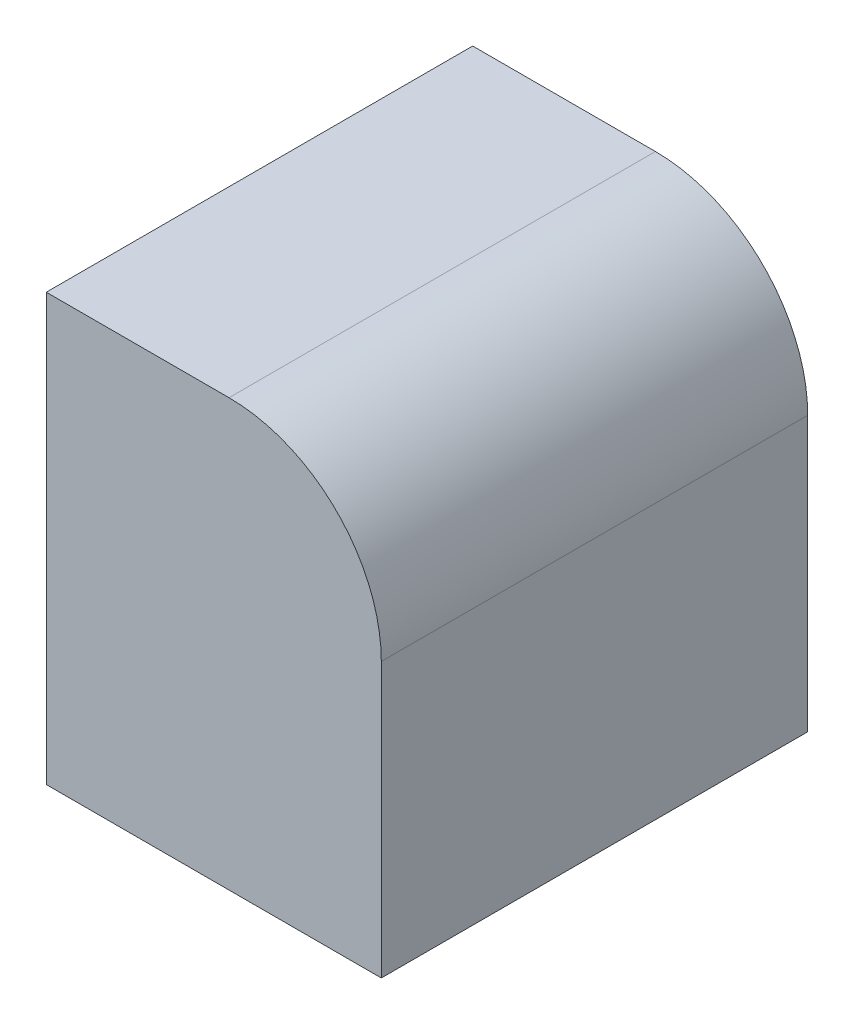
SolidWorks part; units mm, degrees
ref_plane "Front Plane" through (0, 0, 0) normal (0, 0, 1) x (1, 0, 0)
ref_plane "Top Plane" through (0, 0, 0) normal (0, 1, 0) x (1, 0, 0)
ref_plane "Right Plane" through (0, 0, 0) normal (1, 0, 0) x (0, 0, -1)
sketch "Sketch1" plane through (0, 0, 0) normal (1, 0, 0) x (0, 0, -1)
  line L1 (0, 0) -> (70, 0)
  line L2 (0, 0) -> (0, 70)
  line L3 (0, 70) -> (70, 70)
  line L4 (70, 0) -> (70, 70)
  dimension "D1" = 70
  dimension "D2" = 70
extrude "Boss-Extrude1" add sketch "Sketch1" along normal blind 55
fillet "Circular" radius 25 1 edges at (55, 70, -35)
sketch "Circular Profile"
fillet "Conic Rho" [suppressed] radius 25
sketch "Conic Profile 1" [suppressed] plane through (0, 0, 0) normal (0, 0, 1) x (1, 0, 0)
  spline S0 degree 2 poles (-494.058, -2903.9282) (72.149, -81.5934) (54.4644, 55.7847) (54.0651, 58.8862) (53.3213, 61.0643) (52.3438, 63.9266) (50.5847, 65.6651) (48.839, 67.3903) (45.9755, 68.3513) (43.8021, 69.0808) (40.7146, 69.4733) (-97.0074, 86.9815) (-2919.2807, -477.5552) knots -8.004243 -8.004243 -8.004243 0.25 0.25 0.375 0.375 0.5 0.5 0.625 0.625 0.75 0.75 9.061034 9.061034 9.061034 only from (55, 45) to (30, 70) construction
  spline S1 degree 2 poles (55, 45) (55, 51.6238) (54.4644, 55.7847) (54.0651, 58.8862) (53.3213, 61.0643) (52.3438, 63.9266) (50.5847, 65.6651) (48.839, 67.3903) (45.9755, 68.3513) (43.8021, 69.0808) (40.7146, 69.4733) (36.5718, 70) (30, 70) knots 0 0 0 0.25 0.25 0.375 0.375 0.5 0.5 0.625 0.625 0.75 0.75 1 1 1
fillet "Conic Radius" [suppressed] radius 25
sketch "Conic Profile 2" [suppressed] plane through (0, 0, 0) normal (0, 0, 1) x (1, 0, 0)
  spline S0 degree 2 poles (-552.787, -2892.3055) (73.7483, -83.6807) (54.4217, 55.7337) (53.9983, 58.7876) (53.2199, 60.9617) (52.2136, 63.772) (50.4463, 65.521) (48.6912, 67.2578) (45.88, 68.2489) (43.7064, 69.0152) (40.6572, 69.4322) (-99.1345, 88.5505) (-2907.7128, -536.071) knots -8.104548 -8.104548 -8.104548 0.25 0.25 0.375 0.375 0.5 0.5 0.625 0.625 0.75 0.75 9.167861 9.167861 9.167861 only from (55, 45) to (30, 70) construction
  spline S1 degree 2 poles (55, 45) (55, 51.5619) (54.4217, 55.7337) (53.9983, 58.7876) (53.2199, 60.9617) (52.2136, 63.772) (50.4463, 65.521) (48.6912, 67.2578) (45.88, 68.2489) (43.7064, 69.0152) (40.6572, 69.4322) (36.5056, 70) (30, 70) knots 0 0 0 0.25 0.25 0.375 0.375 0.5 0.5 0.625 0.625 0.75 0.75 1 1 1
fillet "Curvature Continuous" [suppressed] radius 25
sketch "Spline Profile" [suppressed] plane through (0, 0, 0) normal (0, 0, 1) x (1, 0, 0)
  spline S0 degree 2 poles (41.1337, -2954.9025) (55.1686, 9.8099) (54.9979, 46.2997) (54.9946, 47.0129) (54.9842, 47.5984) (54.959, 49.0068) (54.8827, 50.189) (54.7953, 51.541) (54.6321, 52.7659) (54.4545, 54.0992) (54.1821, 55.3245) (53.5766, 58.0472) (52.5023, 60.2496) (51.3045, 62.7052) (49.5274, 64.4891) (47.7449, 66.2784) (45.2848, 67.4851) (43.0846, 68.5642) (40.3604, 69.174) (39.1396, 69.4473) (37.8094, 69.6263) (36.5801, 69.7917) (35.2212, 69.8806) (34.0314, 69.9583) (32.6117, 69.9839) (32.024, 69.9945) (31.3059, 69.9979) (-5.1635, 70.1704) (-2969.9217, 56.0462) knots -2.5694 -2.5694 -2.5694 0.03125 0.03125 0.0625 0.0625 0.125 0.125 0.1875 0.1875 0.25 0.25 0.375 0.375 0.5 0.5 0.625 0.625 0.75 0.75 0.8125 0.8125 0.875 0.875 0.9375 0.9375 0.96875 0.96875 3.559355 3.559355 3.559355 only from (55, 45) to (30, 70) construction
  spline S1 degree 2 poles (55, 45) (55, 45.8613) (54.9979, 46.2997) (54.9946, 47.0129) (54.9842, 47.5984) (54.959, 49.0068) (54.8827, 50.189) (54.7953, 51.541) (54.6321, 52.7659) (54.4545, 54.0992) (54.1821, 55.3245) (53.5766, 58.0472) (52.5023, 60.2496) (51.3045, 62.7052) (49.5274, 64.4891) (47.7449, 66.2784) (45.2848, 67.4851) (43.0846, 68.5642) (40.3604, 69.174) (39.1396, 69.4473) (37.8094, 69.6263) (36.5801, 69.7917) (35.2212, 69.8806) (34.0314, 69.9583) (32.6117, 69.9839) (32.024, 69.9945) (31.3059, 69.9979) (30.866, 70) (30, 70) knots 0 0 0 0.03125 0.03125 0.0625 0.0625 0.125 0.125 0.1875 0.1875 0.25 0.25 0.375 0.375 0.5 0.5 0.625 0.625 0.75 0.75 0.8125 0.8125 0.875 0.875 0.9375 0.9375 0.96875 0.96875 1 1 1
fillet "Elliptic" [suppressed] radius 25
sketch "Elliptical Profile" [suppressed] plane through (0, 0, 0) normal (0, 0, 1) x (1, 0, 0)
  spline S0 degree 2 poles (-2906.2211, -410.1447) (105.3284, -55.4917) (54.1446, 58.8902) (53.3662, 60.6298) (51.9223, 62.2103) (49.4677, 64.8971) (45.4522, 66.7916) (42.0269, 68.4077) (37.8909, 69.2332) (-195.1595, 115.7506) (-1192.3632, -2659.6738) knots -7.354741 -7.354741 -7.354741 0.125 0.125 0.25 0.25 0.5 0.5 0.75 0.75 15.91604 15.91604 15.91604 only from (55, 55) to (30, 70) construction
  spline S1 degree 2 poles (55, 55) (55, 56.9786) (54.1446, 58.8902) (53.3662, 60.6298) (51.9223, 62.2103) (49.4677, 64.8971) (45.4522, 66.7916) (42.0269, 68.4077) (37.8909, 69.2332) (34.0493, 70) (30, 70) knots 0 0 0 0.125 0.125 0.25 0.25 0.5 0.5 0.75 0.75 1 1 1
